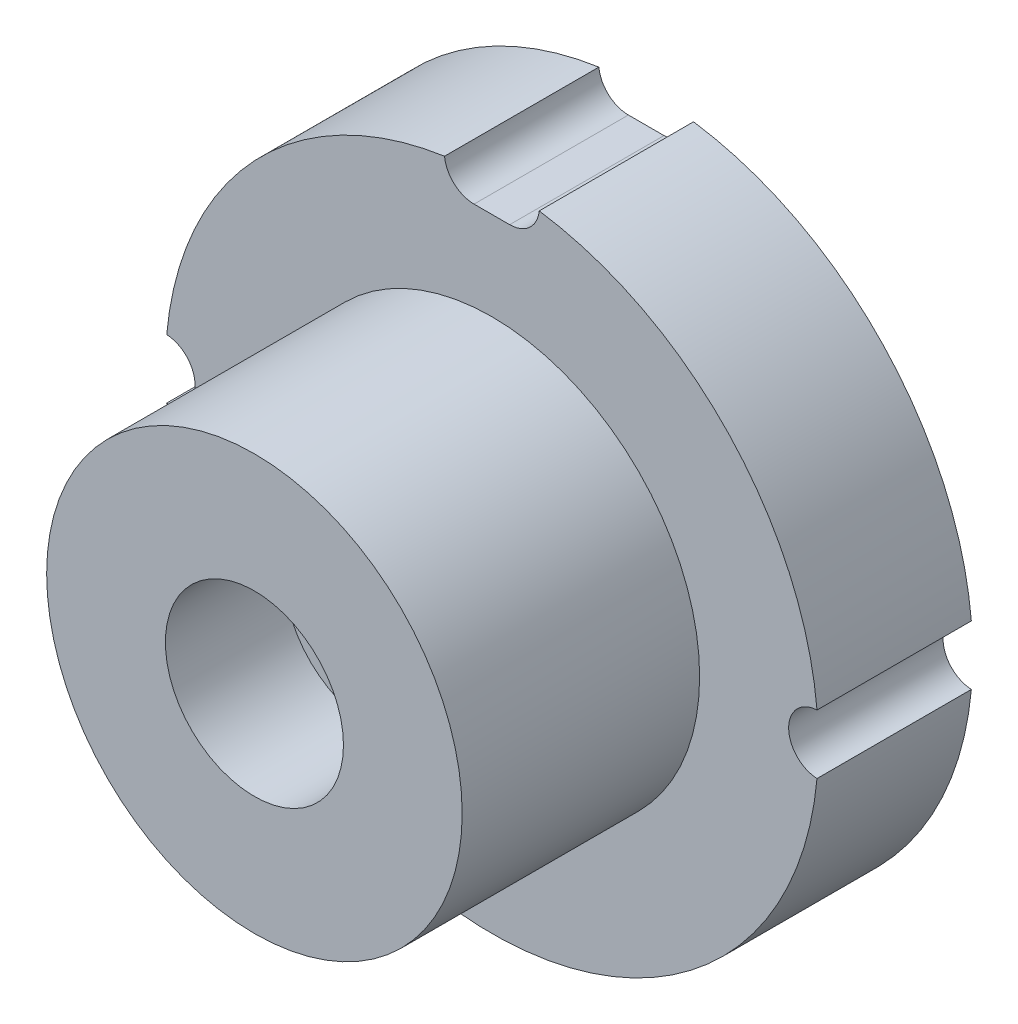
SolidWorks part; units mm, degrees
ref_plane "Face" through (0, 0, 0) normal (0, 0, 1) x (1, 0, 0)
ref_plane "Dessus" through (0, 0, 0) normal (0, 1, 0) x (1, 0, 0)
ref_plane "Droite" through (0, 0, 0) normal (1, 0, 0) x (0, 0, -1)
sketch "Esquisse1" plane through (0, 0, 0) normal (0, 0, 1) x (1, 0, 0)
  circle A0 centre (0, 0) radius 2.75
  dimension "D1" = 5.5
extrude "Extrusion1" add sketch "Esquisse1" along normal blind 1.3
sketch "Esquisse2" plane through (0, 0, 1.3) normal (0, 0, 1) x (1, 0, 0)
  circle A0 centre (0, 0) radius 1.75
  dimension "D1" = 3.5
extrude "Extrusion2" add sketch "Esquisse2" along normal blind 2
sketch "Esquisse3" plane through (0, 0, 3.3) normal (0, 0, 1) x (1, 0, 0)
  circle A0 centre (0, 0) radius 0.75
  dimension "D1" = 1.5
extrude "Enlèv. mat.-Extru.1" cut sketch "Esquisse3" against normal blind 1
sketch "Esquisse4" plane through (0, 0, 0) normal (0, 0, -1) x (-1, 0, 0)
  line L0 (-0.15, 2.4959) -> (0.15, 2.4959)
  circle A0 centre (-2.75, 0) radius 0.25
  circle A1 centre (0, 0) radius 2.75 construction
  circle A2 centre (2.75, 0) radius 0.25
  arc A3 (0, 2.9459) -> (-0.15, 2.4959) centre (-0.15, 2.7459) ccw
  arc A4 (0.15, 2.4959) -> (0, 2.9459) centre (0.15, 2.7459) ccw
  dimension "D1" = 0.5
  dimension "D2" = 0.5
  dimension "D3" = 0.5
  dimension "D4" = 0.5
  dimension "D5" = 0.15
  dimension "D6" = 0.15
extrude "Enlèv. mat.-Extru.2" cut sketch "Esquisse4" against normal through all
sketch "Esquisse5" plane through (0, 0, 0) normal (0, 0, -1) x (-1, 0, 0)
  circle A0 centre (-1, 0) radius 0.5
  circle A1 centre (1, 0) radius 0.5
  circle A2 centre (0, 1) radius 0.5
  dimension "D1" = 1
  dimension "D2" = 1
  dimension "D5" = 1
  dimension "D3" = 1
  dimension "D4" = 1
  dimension "D6" = 1
extrude "Enlèv. mat.-Extru.3" cut sketch "Esquisse5" against normal blind 1
